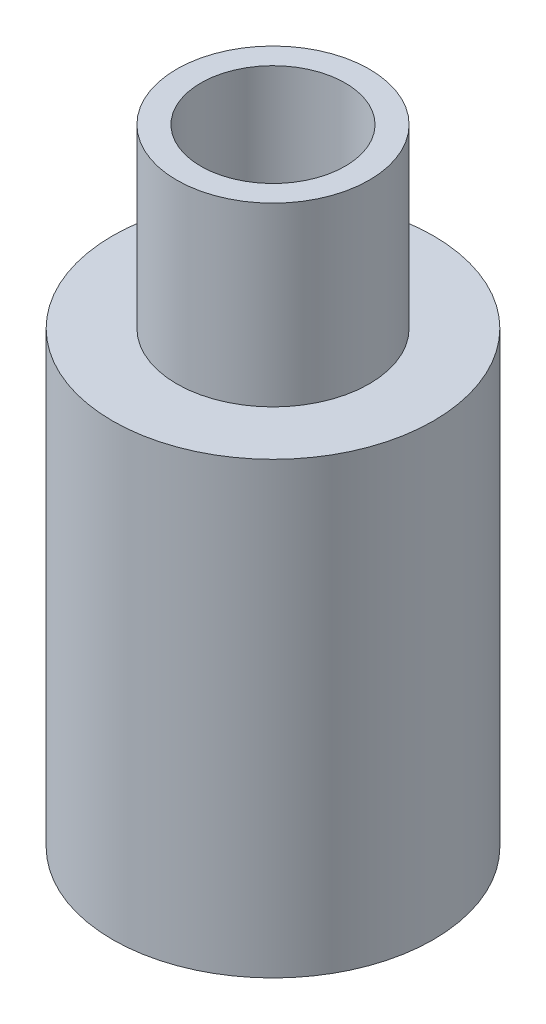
SolidWorks part; units mm, degrees
ref_plane "Front Plane" through (0, 0, 0) normal (0, 0, 1) x (1, 0, 0)
ref_plane "Top Plane" through (0, 0, 0) normal (0, 1, 0) x (1, 0, 0)
ref_plane "Right Plane" through (0, 0, 0) normal (1, 0, 0) x (0, 0, -1)
sketch "Sketch1" plane through (0, 0, 0) normal (0, 1, 0) x (1, 0, 0)
  circle A0 centre (0, 0) radius 5
  dimension "D1" = 10
extrude "Extrude1" add sketch "Sketch1" along normal blind 14
sketch "Sketch2" plane through (0, 14, 0) normal (0, 1, 0) x (1, 0, 0)
  circle A0 centre (0, 0) radius 3
  dimension "D1" = 6
extrude "Extrude2" add sketch "Sketch2" along normal blind 5.5
sketch "Sketch3" plane through (0, 19.5, 0) normal (0, 1, 0) x (1, 0, 0)
  circle A0 centre (0, 0) radius 2.25
  dimension "D1" = 4.5
extrude "Extrude3" cut sketch "Sketch3" against normal through all
